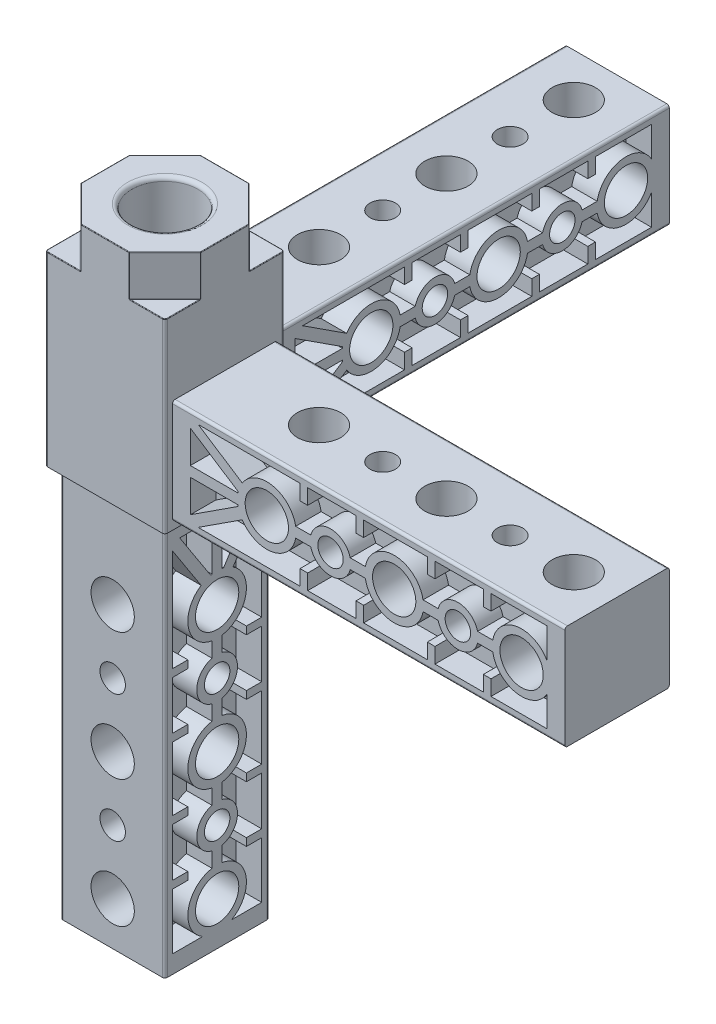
SolidWorks part; units mm, degrees
ref_plane "前视基准面" through (0, 0, 0) normal (0, 0, 1) x (1, 0, 0)
ref_plane "上视基准面" through (0, 0, 0) normal (0, 1, 0) x (1, 0, 0)
ref_plane "右视基准面" through (0, 0, 0) normal (1, 0, 0) x (0, 0, -1)
sketch "草图1" plane through (0, 0, 0) normal (0, 1, 0) x (1, 0, 0)
  line L1 (-11.25, -11.75) -> (11.25, -11.75)
  line L2 (-11.75, -11.25) -> (-11.75, 11.25)
  line L3 (-11.25, 11.75) -> (11.25, 11.75)
  line L4 (11.75, -11.25) -> (11.75, 11.25)
  line L5 (-11.75, -11.75) -> (11.75, 11.75) construction
  line L6 (-11.75, 11.75) -> (11.75, -11.75) construction
  arc A0 (-11.25, -11.75) -> (-11.75, -11.25) centre (-11.25, -11.25) cw
  arc A1 (-11.75, 11.25) -> (-11.25, 11.75) centre (-11.25, 11.25) cw
  arc A2 (11.25, 11.75) -> (11.75, 11.25) centre (11.25, 11.25) cw
  arc A3 (11.25, -11.75) -> (11.75, -11.25) centre (11.25, -11.25) ccw
  point P0 (0, 0)
  dimension "D3" = 0.5
  dimension "D1" = 23.5
  dimension "D2" = 23.5
extrude "拉伸1" add sketch "草图1" along normal blind 44.5
sketch "草图2" plane through (0, 44.5, 0) normal (0, 1, 0) x (1, 0, 0)
  line L0 (0, 0) -> (50000, 0) construction
  line L1 (0, 0) -> (0, 50000) construction
  line L2 (-11.25, -11.75) -> (11.25, -11.75) construction
  line L3 (11.75, -11.25) -> (11.75, 11.25) construction
  line L4 (-11.75, 11.25) -> (-11.75, -11.25) construction
  line L5 (11.25, 11.75) -> (-11.25, 11.75) construction
  line L6 (-11.25, -11.75) -> (-4.75, -11.75)
  line L7 (11.75, -11.25) -> (11.75, -4.75)
  line L8 (-11.75, 11.25) -> (-11.75, 4.75)
  line L9 (11.25, 11.75) -> (4.75, 11.75)
  line L10 (-4.75, 11.75) -> (-11.75, 4.75)
  line L11 (4.75, 11.75) -> (11.75, 4.75)
  line L12 (4.75, -11.75) -> (11.75, -4.75)
  line L13 (-4.75, -11.75) -> (-11.75, -4.75)
  line L14 (4.75, -11.75) -> (11.25, -11.75)
  line L15 (-11.75, -4.75) -> (-11.75, -11.25)
  line L16 (11.75, 4.75) -> (11.75, 11.25)
  line L17 (-4.75, 11.75) -> (-11.25, 11.75)
  arc A0 (-11.75, -11.25) -> (-11.25, -11.75) centre (-11.25, -11.25) ccw construction
  arc A1 (11.25, -11.75) -> (11.75, -11.25) centre (11.25, -11.25) ccw construction
  arc A2 (11.75, 11.25) -> (11.25, 11.75) centre (11.25, 11.25) ccw construction
  arc A3 (-11.25, 11.75) -> (-11.75, 11.25) centre (-11.25, 11.25) ccw construction
  arc A4 (-11.75, -11.25) -> (-11.25, -11.75) centre (-11.25, -11.25) ccw
  arc A5 (11.25, -11.75) -> (11.75, -11.25) centre (11.25, -11.25) ccw
  arc A6 (11.75, 11.25) -> (11.25, 11.75) centre (11.25, 11.25) ccw
  arc A7 (-11.25, 11.75) -> (-11.75, 11.25) centre (-11.25, 11.25) ccw
  dimension "D1" = 45
  dimension "D2" = 7
extrude "拉伸2" cut sketch "草图2" against normal blind 8
sketch "草图3" plane through (0, 44.5, 0) normal (0, 1, 0) x (1, 0, 0)
  circle A0 centre (0, 0) radius 6.5
  dimension "D1" = 13
extrude "拉伸3" cut sketch "草图3" against normal blind 25
fillet "圆角1" radius 0.8 1 edges at (0, 44.5, 6.5)
fillet "圆角2" radius 0.1 32 edges at (11.75, 40.5, -4.75) (11.75, 36.5, -8) (11.6036, 36.5, 11.6036) (-11.6036, 36.5, 11.6036) (11.6036, 36.5, -11.6036) (11.75, 36.5, 8) (8, 36.5, 11.75) (-8, 36.5, 11.75) (-11.75, 36.5, 8) (8, 36.5, -11.75) (11.75, 40.5, 4.75) (8.25, 36.5, 8.25) (4.75, 40.5, 11.75) (8.25, 44.5, 8.25) (-4.75, 40.5, 11.75) (-8.25, 36.5, 8.25) (-11.75, 40.5, 4.75) (-8.25, 44.5, 8.25) (-11.75, 40.5, -4.75) (-4.75, 40.5, -11.75) (-8.25, 44.5, -8.25) (-8, 36.5, -11.75) (-8.25, 36.5, -8.25) (-11.75, 36.5, -8) (-11.6036, 36.5, -11.6036) (0, 44.5, 11.75) (-11.75, 44.5, 0) (8.25, 36.5, -8.25) (4.75, 40.5, -11.75) (0, 44.5, -11.75) (8.25, 44.5, -8.25) (11.75, 44.5, 0)
sketch "草图4" plane through (0, 0, 0) normal (0, -1, 0) x (1, 0, 0)
  line L1 (-9.75, -10.25) -> (9.75, -10.25)
  line L2 (-10.25, -9.75) -> (-10.25, 9.75)
  line L3 (-9.75, 10.25) -> (9.75, 10.25)
  line L4 (10.25, -9.75) -> (10.25, 9.75)
  line L5 (-10.25, -10.25) -> (10.25, 10.25) construction
  line L6 (-10.25, 10.25) -> (10.25, -10.25) construction
  arc A0 (-10.25, 9.75) -> (-9.75, 10.25) centre (-9.75, 9.75) cw
  arc A1 (9.75, 10.25) -> (10.25, 9.75) centre (9.75, 9.75) cw
  arc A2 (9.75, -10.25) -> (10.25, -9.75) centre (9.75, -9.75) ccw
  arc A3 (-9.75, -10.25) -> (-10.25, -9.75) centre (-9.75, -9.75) cw
  point P0 (0, 0)
  dimension "D3" = 0.5
  dimension "D1" = 20.5
  dimension "D2" = 20.5
extrude "拉伸4" add sketch "草图4" along normal blind 77
sketch "草图5" plane through (11.75, 0, 0) normal (1, 0, 0) x (0, 0, -1)
  line L0 (0, 0) -> (0, 44.4) construction
  line L1 (4.7086, 44.4) -> (-4.7086, 44.4) construction
  line L2 (9.75, 0) -> (-9.75, 0) construction
  line L3 (-9.75, 1.5) -> (9.75, 1.5)
  line L4 (-10.25, 2) -> (-10.25, 21.5)
  line L5 (-9.75, 22) -> (9.75, 22)
  line L6 (10.25, 2) -> (10.25, 21.5)
  line L7 (-10.25, 1.5) -> (10.25, 22) construction
  line L8 (-10.25, 22) -> (10.25, 1.5) construction
  arc A0 (-10.25, 21.5) -> (-9.75, 22) centre (-9.75, 21.5) cw
  arc A1 (9.75, 22) -> (10.25, 21.5) centre (9.75, 21.5) cw
  arc A2 (-9.75, 1.5) -> (-10.25, 2) centre (-9.75, 2) cw
  arc A3 (9.75, 1.5) -> (10.25, 2) centre (9.75, 2) ccw
  point P5 (0, 11.75)
  dimension "D4" = 0.5
  dimension "D1" = 1.5
  dimension "D2" = 20.5
  dimension "D3" = 20.5
extrude "拉伸5" add sketch "草图5" along normal blind 77
sketch "草图6" plane through (0, 0, -11.75) normal (0, 0, -1) x (-1, 0, 0)
  line L0 (0, 44.4) -> (0, 0) construction
  line L1 (4.7086, 44.4) -> (-4.7086, 44.4) construction
  line L2 (9.75, 0) -> (-9.75, 0) construction
  line L3 (-9.75, 1.5) -> (9.75, 1.5)
  line L4 (-10.25, 2) -> (-10.25, 21.5)
  line L5 (-9.75, 22) -> (9.75, 22)
  line L6 (10.25, 2) -> (10.25, 21.5)
  line L7 (-10.25, 1.5) -> (10.25, 22) construction
  line L8 (-10.25, 22) -> (10.25, 1.5) construction
  arc A0 (-10.25, 21.5) -> (-9.75, 22) centre (-9.75, 21.5) cw
  arc A1 (-9.75, 1.5) -> (-10.25, 2) centre (-9.75, 2) cw
  arc A2 (9.75, 1.5) -> (10.25, 2) centre (9.75, 2) ccw
  arc A3 (9.75, 22) -> (10.25, 21.5) centre (9.75, 21.5) cw
  point P5 (0, 11.75)
  dimension "D4" = 0.5
  dimension "D1" = 20.5
  dimension "D2" = 20.5
  dimension "D3" = 1.5
extrude "拉伸6" add sketch "草图6" along normal blind 77
sketch "草图7"
sketch_block_instance "块1-1"
sketch_block "块1" parameters "D8"=11.5, "D9"=8, "D20"=5.75, "D21"=4, "D22"=5.75, "D1"=2, "D2"=33, "D3"=2, "D4"=12.5, "D5"=12.5, "D6"=12.5, "D7"=12.5, "D10"=2, "D11"=3, "D12"=1.5, "D13"=9.4789, "D14"=12.5, "D15"=9.5, "D16"=11, "D17"=1.5, "D18"=1.5, "D19"=1.5
extrude "拉伸7" cut sketch "草图7" against normal blind 5
sketch "草图8" plane through (-10.25, 0, 0) normal (-1, 0, 0) x (0, 0, 1)
  line L52 (-7.3564, -3.5) -> (-1, -3.5)
  line L53 (-1, -3.5) -> (-1, -12.8376)
  line L54 (-7.3564, -3.5) -> (-1.2588, -12.8895)
  line L55 (-8.75, -5.0262) -> (-3.1317, -13.6776)
  line L56 (-8.75, -25.0211) -> (-8.75, -5.0262)
  line L57 (-8.75, -25.0211) -> (-5.75, -25.0211)
  line L58 (-8.75, -26.5211) -> (-5.75, -26.5211)
  line L59 (-5.75, -26.5211) -> (-5.75, -25.0211)
  line L60 (1, -27.127) -> (1, -24.1624)
  line L61 (-1, -27.127) -> (-1, -24.1624)
  line L62 (1, -3.5) -> (7.3564, -3.5)
  line L63 (1, -12.8376) -> (1, -3.5)
  line L64 (1.2588, -12.8895) -> (7.3564, -3.5)
  line L65 (3.1317, -13.6776) -> (8.75, -5.0262)
  line L66 (8.75, -5.0262) -> (8.75, -25.0211)
  line L67 (8.75, -25.0211) -> (5.75, -25.0211)
  line L68 (5.75, -25.0211) -> (5.75, -26.5211)
  line L69 (8.75, -36) -> (8.75, -26.5211)
  line L70 (5.75, -26.5211) -> (8.75, -26.5211)
  line L71 (-8.75, -36) -> (-8.75, -26.5211)
  line L72 (-8.75, -36) -> (-5.75, -36)
  line L73 (-5.75, -37.5) -> (-5.75, -36)
  line L74 (-8.75, -37.5) -> (-5.75, -37.5)
  line L75 (-1, -37.8376) -> (-1, -34.873)
  line L76 (1, -37.8376) -> (1, -34.873)
  line L77 (5.75, -37.5) -> (5.75, -36)
  line L78 (8.75, -36) -> (5.75, -36)
  line L79 (5.75, -37.5) -> (8.75, -37.5)
  line L80 (8.75, -50) -> (8.75, -37.5)
  line L81 (8.75, -50) -> (5.75, -50)
  line L82 (5.75, -51.5) -> (5.75, -50)
  line L83 (5.75, -51.5) -> (8.75, -51.5)
  line L84 (8.75, -61) -> (8.75, -51.5)
  line L85 (5.75, -62.5) -> (5.75, -61)
  line L86 (8.75, -61) -> (5.75, -61)
  line L87 (5.75, -62.5) -> (8.75, -62.5)
  line L88 (-1, -52.127) -> (-1, -49.1624)
  line L89 (1, -52.127) -> (1, -49.1624)
  line L90 (-8.75, -50) -> (-8.75, -37.5)
  line L91 (-8.75, -50) -> (-5.75, -50)
  line L92 (-5.75, -51.5) -> (-5.75, -50)
  line L93 (-8.75, -51.5) -> (-5.75, -51.5)
  line L94 (-8.75, -61) -> (-8.75, -51.5)
  line L95 (-5.75, -62.5) -> (-5.75, -61)
  line L96 (-8.75, -61) -> (-5.75, -61)
  line L97 (-8.75, -62.5) -> (-5.75, -62.5)
  line L98 (-8.75, -73.5) -> (-8.75, -62.5)
  line L99 (-8.75, -73.5) -> (-2.8395, -73.5)
  line L100 (-1, -62.8376) -> (-1, -59.873)
  line L101 (1, -62.8376) -> (1, -59.873)
  line L102 (8.75, -73.5) -> (8.75, -62.5)
  line L103 (8.75, -73.5) -> (2.8395, -73.5)
  line L104 (1, -3.5) -> (7.3564, -3.5)
  line L105 (-1, -52.127) -> (-1, -49.1624)
  line L106 (-1, -37.8376) -> (-1, -34.873)
  line L107 (-1, -27.127) -> (-1, -24.1624)
  line L108 (-1, -12.8376) -> (-1, -3.5)
  line L109 (-8.75, -61) -> (-8.75, -51.5)
  line L110 (-8.75, -50) -> (-8.75, -37.5)
  line L111 (-8.75, -36) -> (-8.75, -26.5211)
  line L112 (-8.75, -25.0211) -> (-8.75, -5.0262)
  line L113 (5.75, -25.0211) -> (8.75, -25.0211)
  line L114 (5.75, -26.5211) -> (8.75, -26.5211)
  line L115 (-5.75, -51.5) -> (-5.75, -50)
  line L116 (-5.75, -37.5) -> (-5.75, -36)
  line L117 (-5.75, -26.5211) -> (-5.75, -25.0211)
  line L118 (1, -52.127) -> (1, -49.1624)
  line L119 (1, -37.8376) -> (1, -34.873)
  line L120 (1, -27.127) -> (1, -24.1624)
  line L121 (1, -12.8376) -> (1, -3.5)
  line L122 (8.75, -61) -> (8.75, -51.5)
  line L123 (8.75, -50) -> (8.75, -37.5)
  line L124 (8.75, -36) -> (8.75, -26.5211)
  line L125 (8.75, -25.0211) -> (8.75, -5.0262)
  line L126 (5.75, -51.5) -> (5.75, -50)
  line L127 (5.75, -37.5) -> (5.75, -36)
  line L128 (5.75, -26.5211) -> (5.75, -25.0211)
  line L129 (5.75, -36) -> (8.75, -36)
  line L130 (5.75, -37.5) -> (8.75, -37.5)
  line L131 (5.75, -50) -> (8.75, -50)
  line L132 (5.75, -51.5) -> (8.75, -51.5)
  line L133 (5.75, -61) -> (8.75, -61)
  line L134 (5.75, -62.5) -> (8.75, -62.5)
  line L135 (2.8395, -73.5) -> (8.75, -73.5)
  arc A0 (-3.1317, -13.6776) -> (-1, -24.1624) centre (0, -18.5) ccw construction
  arc A1 (1, -24.1624) -> (3.1317, -13.6776) centre (0, -18.5) ccw construction
  arc A2 (-1, -27.127) -> (-1, -34.873) centre (0, -31) ccw construction
  arc A3 (1, -34.873) -> (1, -27.127) centre (0, -31) ccw construction
  arc A4 (1, -59.873) -> (1, -52.127) centre (0, -56) ccw construction
  arc A5 (-1, -52.127) -> (-1, -59.873) centre (0, -56) ccw construction
  arc A6 (1, -49.1624) -> (1, -37.8376) centre (0, -43.5) ccw construction
  arc A7 (-1, -37.8376) -> (-1, -49.1624) centre (0, -43.5) ccw construction
  arc A8 (-1, -62.8376) -> (-2.8395, -73.5) centre (0, -68.5) ccw construction
  arc A9 (2.8395, -73.5) -> (1, -62.8376) centre (0, -68.5) ccw construction
  arc A10 (-3.1317, -13.6776) -> (-1, -24.1624) centre (0, -18.5) ccw
  arc A11 (1, -24.1624) -> (3.1317, -13.6776) centre (0, -18.5) ccw
  arc A12 (-1, -27.127) -> (-1, -34.873) centre (0, -31) ccw
  arc A13 (1, -34.873) -> (1, -27.127) centre (0, -31) ccw
  arc A14 (1, -59.873) -> (1, -52.127) centre (0, -56) ccw
  arc A15 (-1, -52.127) -> (-1, -59.873) centre (0, -56) ccw
  arc A16 (1, -49.1624) -> (1, -37.8376) centre (0, -43.5) ccw
  arc A17 (-1, -37.8376) -> (-1, -49.1624) centre (0, -43.5) ccw
  arc A18 (-1, -62.8376) -> (-2.8395, -73.5) centre (0, -68.5) ccw
  arc A19 (2.8395, -73.5) -> (1, -62.8376) centre (0, -68.5) ccw
  arc A20 (-1, -12.8376) -> (-1.2588, -12.8895) centre (0, -18.5) ccw construction
  arc A21 (1.2588, -12.8895) -> (1, -12.8376) centre (0, -18.5) ccw construction
  arc A22 (-1, -12.8376) -> (-1.2588, -12.8895) centre (0, -18.5) ccw
  arc A23 (1.2588, -12.8895) -> (1, -12.8376) centre (0, -18.5) ccw
extrude "拉伸8" cut sketch "草图8" against normal blind 5 contours A18 L100 A15 L88 A17 L75 A12 L61 A10 L55 L56 L57 L59 L58 L71 L72 L73 L74 L90 L91 L92 L93 L94 L96 L95 L97 L98 L99 | A22 L53 L52 L54 | A23 L64 L62 L63 | A19 L103 L102 L87 L85 L86 L84 L83 L82 L81 L80 L79 L77 L78 L69 L70 L68 L67 L66 L65 A11 L60 A13 L76 A16 L89 A14 L101
sketch "草图9" plane through (0, 0, -10.25) normal (0, 0, -1) x (-1, 0, 0)
  line L0 (-11.75, 2) -> (-11.75, 21.5) construction
  line B0 (-85.25, 20.5) -> (-85.25, 14.5895)
  line B1 (-85.25, 20.5) -> (-74.25, 20.5)
  line B2 (-85.25, 3) -> (-74.25, 3)
  line B3 (-15.25, 10.75) -> (-24.5876, 10.75)
  line B4 (-74.5876, 12.75) -> (-71.623, 12.75)
  line B5 (-16.7762, 20.5) -> (-25.4276, 14.8817)
  line B6 (-15.25, 19.1064) -> (-15.25, 12.75)
  line B7 (-15.25, 19.1064) -> (-24.6395, 13.0088)
  line B8 (-16.7762, 3) -> (-25.4276, 8.6183)
  line B9 (-15.25, 4.3936) -> (-24.6395, 10.4912)
  line B10 (-47.75, 3) -> (-47.75, 6)
  line B11 (-36.7711, 3) -> (-36.7711, 6)
  line B12 (-72.75, 17.5) -> (-74.25, 17.5)
  line B13 (-38.2711, 3) -> (-38.2711, 6)
  line B14 (-36.7711, 6) -> (-38.2711, 6)
  line B15 (-74.25, 20.5) -> (-74.25, 17.5)
  line B16 (-49.25, 3) -> (-49.25, 6)
  line B17 (-47.75, 6) -> (-49.25, 6)
  line B18 (-61.75, 3) -> (-61.75, 6)
  line B19 (-72.75, 20.5) -> (-72.75, 17.5)
  line B20 (-63.25, 3) -> (-63.25, 6)
  line B21 (-61.75, 6) -> (-63.25, 6)
  line B22 (-72.75, 3) -> (-72.75, 6)
  line B23 (-61.75, 17.5) -> (-63.25, 17.5)
  line B24 (-74.25, 3) -> (-74.25, 6)
  line B25 (-72.75, 6) -> (-74.25, 6)
  line B26 (-63.25, 20.5) -> (-63.25, 17.5)
  line B27 (-61.75, 20.5) -> (-61.75, 17.5)
  line B28 (-47.75, 17.5) -> (-49.25, 17.5)
  line B29 (-49.25, 20.5) -> (-49.25, 17.5)
  line B30 (-36.7711, 17.5) -> (-38.2711, 17.5)
  line B31 (-38.2711, 20.5) -> (-38.2711, 17.5)
  line B32 (-36.7711, 20.5) -> (-36.7711, 17.5)
  line B33 (-47.75, 20.5) -> (-47.75, 17.5)
  line B34 (-85.25, 8.9105) -> (-85.25, 3)
  line B35 (-63.877, 12.75) -> (-60.9124, 12.75)
  line B36 (-71.623, 10.75) -> (-74.5876, 10.75)
  line B37 (-72.75, 3) -> (-63.25, 3)
  line B38 (-72.75, 20.5) -> (-63.25, 20.5)
  line B39 (-61.75, 20.5) -> (-49.25, 20.5)
  line B40 (-60.9124, 10.75) -> (-63.877, 10.75)
  line B41 (-49.5876, 12.75) -> (-46.623, 12.75)
  line B42 (-61.75, 3) -> (-49.25, 3)
  line B43 (-47.75, 3) -> (-38.2711, 3)
  line B44 (-47.75, 20.5) -> (-38.2711, 20.5)
  line B45 (-36.7711, 20.5) -> (-16.7762, 20.5)
  line B46 (-36.7711, 3) -> (-16.7762, 3)
  line B47 (-46.623, 10.75) -> (-49.5876, 10.75)
  line B48 (-38.877, 12.75) -> (-35.9124, 12.75)
  line B49 (-35.9124, 10.75) -> (-38.877, 10.75)
  line B50 (-24.5876, 12.75) -> (-15.25, 12.75)
  line B51 (-15.25, 10.75) -> (-15.25, 4.3936)
  arc B52 (-85.25, 8.9105) -> (-74.5876, 10.75) centre (-80.25, 11.75) ccw
  arc B53 (-63.877, 12.75) -> (-71.623, 12.75) centre (-67.75, 11.75) ccw
  arc B54 (-49.5876, 12.75) -> (-60.9124, 12.75) centre (-55.25, 11.75) ccw
  arc B55 (-38.877, 12.75) -> (-46.623, 12.75) centre (-42.75, 11.75) ccw
  arc B56 (-24.6395, 10.4912) -> (-24.5876, 10.75) centre (-30.25, 11.75) ccw
  arc B57 (-35.9124, 10.75) -> (-25.4276, 8.6183) centre (-30.25, 11.75) ccw
  arc B58 (-46.623, 10.75) -> (-38.877, 10.75) centre (-42.75, 11.75) ccw
  arc B59 (-60.9124, 10.75) -> (-49.5876, 10.75) centre (-55.25, 11.75) ccw
  arc B60 (-71.623, 10.75) -> (-63.877, 10.75) centre (-67.75, 11.75) ccw
  arc B61 (-74.5876, 12.75) -> (-85.25, 14.5895) centre (-80.25, 11.75) ccw
  arc B62 (-24.5876, 12.75) -> (-24.6395, 13.0088) centre (-30.25, 11.75) ccw
  arc B63 (-25.4276, 14.8817) -> (-35.9124, 12.75) centre (-30.25, 11.75) ccw
sketch_block_instance "块1-2"
extrude "拉伸9" cut sketch "草图9" against normal blind 5
sketch "草图10" plane through (0, 0, 10.25) normal (0, 0, 1) x (1, 0, 0)
  line L0 (11.75, 11.75) -> (-19.8741, 11.75) construction
  line L1 (11.75, 21.5) -> (11.75, 2) construction
  line B0 (85.25, 3) -> (85.25, 8.9105)
  line B1 (85.25, 3) -> (74.25, 3)
  line B2 (85.25, 20.5) -> (74.25, 20.5)
  line B3 (15.25, 12.75) -> (24.5876, 12.75)
  line B4 (74.5876, 10.75) -> (71.623, 10.75)
  line B5 (16.7762, 3) -> (25.4276, 8.6183)
  line B6 (15.25, 4.3936) -> (15.25, 10.75)
  line B7 (15.25, 4.3936) -> (24.6395, 10.4912)
  line B8 (16.7762, 20.5) -> (25.4276, 14.8817)
  line B9 (15.25, 19.1064) -> (24.6395, 13.0088)
  line B10 (47.75, 20.5) -> (47.75, 17.5)
  line B11 (36.7711, 20.5) -> (36.7711, 17.5)
  line B12 (72.75, 6) -> (74.25, 6)
  line B13 (38.2711, 20.5) -> (38.2711, 17.5)
  line B14 (36.7711, 17.5) -> (38.2711, 17.5)
  line B15 (74.25, 3) -> (74.25, 6)
  line B16 (49.25, 20.5) -> (49.25, 17.5)
  line B17 (47.75, 17.5) -> (49.25, 17.5)
  line B18 (61.75, 20.5) -> (61.75, 17.5)
  line B19 (72.75, 3) -> (72.75, 6)
  line B20 (63.25, 20.5) -> (63.25, 17.5)
  line B21 (61.75, 17.5) -> (63.25, 17.5)
  line B22 (72.75, 20.5) -> (72.75, 17.5)
  line B23 (61.75, 6) -> (63.25, 6)
  line B24 (74.25, 20.5) -> (74.25, 17.5)
  line B25 (72.75, 17.5) -> (74.25, 17.5)
  line B26 (63.25, 3) -> (63.25, 6)
  line B27 (61.75, 3) -> (61.75, 6)
  line B28 (47.75, 6) -> (49.25, 6)
  line B29 (49.25, 3) -> (49.25, 6)
  line B30 (36.7711, 6) -> (38.2711, 6)
  line B31 (38.2711, 3) -> (38.2711, 6)
  line B32 (36.7711, 3) -> (36.7711, 6)
  line B33 (47.75, 3) -> (47.75, 6)
  line B34 (85.25, 14.5895) -> (85.25, 20.5)
  line B35 (63.877, 10.75) -> (60.9124, 10.75)
  line B36 (71.623, 12.75) -> (74.5876, 12.75)
  line B37 (72.75, 20.5) -> (63.25, 20.5)
  line B38 (72.75, 3) -> (63.25, 3)
  line B39 (61.75, 3) -> (49.25, 3)
  line B40 (60.9124, 12.75) -> (63.877, 12.75)
  line B41 (49.5876, 10.75) -> (46.623, 10.75)
  line B42 (61.75, 20.5) -> (49.25, 20.5)
  line B43 (47.75, 20.5) -> (38.2711, 20.5)
  line B44 (47.75, 3) -> (38.2711, 3)
  line B45 (36.7711, 3) -> (16.7762, 3)
  line B46 (36.7711, 20.5) -> (16.7762, 20.5)
  line B47 (46.623, 12.75) -> (49.5876, 12.75)
  line B48 (38.877, 10.75) -> (35.9124, 10.75)
  line B49 (35.9124, 12.75) -> (38.877, 12.75)
  line B50 (24.5876, 10.75) -> (15.25, 10.75)
  line B51 (15.25, 12.75) -> (15.25, 19.1064)
  arc B52 (85.25, 14.5895) -> (74.5876, 12.75) centre (80.25, 11.75) ccw
  arc B53 (63.877, 10.75) -> (71.623, 10.75) centre (67.75, 11.75) ccw
  arc B54 (49.5876, 10.75) -> (60.9124, 10.75) centre (55.25, 11.75) ccw
  arc B55 (38.877, 10.75) -> (46.623, 10.75) centre (42.75, 11.75) ccw
  arc B56 (24.6395, 13.0088) -> (24.5876, 12.75) centre (30.25, 11.75) ccw
  arc B57 (35.9124, 12.75) -> (25.4276, 14.8817) centre (30.25, 11.75) ccw
  arc B58 (46.623, 12.75) -> (38.877, 12.75) centre (42.75, 11.75) ccw
  arc B59 (60.9124, 12.75) -> (49.5876, 12.75) centre (55.25, 11.75) ccw
  arc B60 (71.623, 12.75) -> (63.877, 12.75) centre (67.75, 11.75) ccw
  arc B61 (74.5876, 10.75) -> (85.25, 8.9105) centre (80.25, 11.75) ccw
  arc B62 (24.5876, 10.75) -> (24.6395, 10.4912) centre (30.25, 11.75) ccw
  arc B63 (25.4276, 8.6183) -> (35.9124, 10.75) centre (30.25, 11.75) ccw
sketch_block_instance "块1-4"
extrude "拉伸10" cut sketch "草图10" against normal blind 5
sketch "草图12" plane through (10.25, 0, 0) normal (1, 0, 0) x (0, 0, -1)
  line L0 (13.25, 11.75) -> (-34.3017, 11.75) construction
  line L2 (11.75, 21.5) -> (11.75, 2) construction
  line B0 (85.25, 3) -> (85.25, 8.9105)
  line B1 (85.25, 3) -> (74.25, 3)
  line B2 (85.25, 20.5) -> (74.25, 20.5)
  line B3 (15.25, 12.75) -> (24.5876, 12.75)
  line B4 (74.5876, 10.75) -> (71.623, 10.75)
  line B5 (16.7762, 3) -> (25.4276, 8.6183)
  line B6 (15.25, 4.3936) -> (15.25, 10.75)
  line B7 (15.25, 4.3936) -> (24.6395, 10.4912)
  line B8 (16.7762, 20.5) -> (25.4276, 14.8817)
  line B9 (15.25, 19.1064) -> (24.6395, 13.0088)
  line B10 (47.75, 20.5) -> (47.75, 17.5)
  line B11 (36.7711, 20.5) -> (36.7711, 17.5)
  line B12 (72.75, 6) -> (74.25, 6)
  line B13 (38.2711, 20.5) -> (38.2711, 17.5)
  line B14 (36.7711, 17.5) -> (38.2711, 17.5)
  line B15 (74.25, 3) -> (74.25, 6)
  line B16 (49.25, 20.5) -> (49.25, 17.5)
  line B17 (47.75, 17.5) -> (49.25, 17.5)
  line B18 (61.75, 20.5) -> (61.75, 17.5)
  line B19 (72.75, 3) -> (72.75, 6)
  line B20 (63.25, 20.5) -> (63.25, 17.5)
  line B21 (61.75, 17.5) -> (63.25, 17.5)
  line B22 (72.75, 20.5) -> (72.75, 17.5)
  line B23 (61.75, 6) -> (63.25, 6)
  line B24 (74.25, 20.5) -> (74.25, 17.5)
  line B25 (72.75, 17.5) -> (74.25, 17.5)
  line B26 (63.25, 3) -> (63.25, 6)
  line B27 (61.75, 3) -> (61.75, 6)
  line B28 (47.75, 6) -> (49.25, 6)
  line B29 (49.25, 3) -> (49.25, 6)
  line B30 (36.7711, 6) -> (38.2711, 6)
  line B31 (38.2711, 3) -> (38.2711, 6)
  line B32 (36.7711, 3) -> (36.7711, 6)
  line B33 (47.75, 3) -> (47.75, 6)
  line B34 (85.25, 14.5895) -> (85.25, 20.5)
  line B35 (63.877, 10.75) -> (60.9124, 10.75)
  line B36 (71.623, 12.75) -> (74.5876, 12.75)
  line B37 (72.75, 20.5) -> (63.25, 20.5)
  line B38 (72.75, 3) -> (63.25, 3)
  line B39 (61.75, 3) -> (49.25, 3)
  line B40 (60.9124, 12.75) -> (63.877, 12.75)
  line B41 (49.5876, 10.75) -> (46.623, 10.75)
  line B42 (61.75, 20.5) -> (49.25, 20.5)
  line B43 (47.75, 20.5) -> (38.2711, 20.5)
  line B44 (47.75, 3) -> (38.2711, 3)
  line B45 (36.7711, 3) -> (16.7762, 3)
  line B46 (36.7711, 20.5) -> (16.7762, 20.5)
  line B47 (46.623, 12.75) -> (49.5876, 12.75)
  line B48 (38.877, 10.75) -> (35.9124, 10.75)
  line B49 (35.9124, 12.75) -> (38.877, 12.75)
  line B50 (24.5876, 10.75) -> (15.25, 10.75)
  line B51 (15.25, 12.75) -> (15.25, 19.1064)
  arc B52 (85.25, 14.5895) -> (74.5876, 12.75) centre (80.25, 11.75) ccw
  arc B53 (63.877, 10.75) -> (71.623, 10.75) centre (67.75, 11.75) ccw
  arc B54 (49.5876, 10.75) -> (60.9124, 10.75) centre (55.25, 11.75) ccw
  arc B55 (38.877, 10.75) -> (46.623, 10.75) centre (42.75, 11.75) ccw
  arc B56 (24.6395, 13.0088) -> (24.5876, 12.75) centre (30.25, 11.75) ccw
  arc B57 (35.9124, 12.75) -> (25.4276, 14.8817) centre (30.25, 11.75) ccw
  arc B58 (46.623, 12.75) -> (38.877, 12.75) centre (42.75, 11.75) ccw
  arc B59 (60.9124, 12.75) -> (49.5876, 12.75) centre (55.25, 11.75) ccw
  arc B60 (71.623, 12.75) -> (63.877, 12.75) centre (67.75, 11.75) ccw
  arc B61 (74.5876, 10.75) -> (85.25, 8.9105) centre (80.25, 11.75) ccw
  arc B62 (24.5876, 10.75) -> (24.6395, 10.4912) centre (30.25, 11.75) ccw
  arc B63 (25.4276, 8.6183) -> (35.9124, 10.75) centre (30.25, 11.75) ccw
sketch_block_instance "块1-6"
extrude "拉伸11" cut sketch "草图12" against normal blind 5
sketch "草图13" plane through (-10.25, 0, 0) normal (-1, 0, 0) x (0, 0, 1)
  line L0 (-11.75, 11.75) -> (27.1926, 11.75) construction
  line L1 (-11.75, 2) -> (-11.75, 21.5) construction
  line B0 (-85.25, 20.5) -> (-85.25, 14.5895)
  line B1 (-85.25, 20.5) -> (-74.25, 20.5)
  line B2 (-85.25, 3) -> (-74.25, 3)
  line B3 (-15.25, 10.75) -> (-24.5876, 10.75)
  line B4 (-74.5876, 12.75) -> (-71.623, 12.75)
  line B5 (-16.7762, 20.5) -> (-25.4276, 14.8817)
  line B6 (-15.25, 19.1064) -> (-15.25, 12.75)
  line B7 (-15.25, 19.1064) -> (-24.6395, 13.0088)
  line B8 (-16.7762, 3) -> (-25.4276, 8.6183)
  line B9 (-15.25, 4.3936) -> (-24.6395, 10.4912)
  line B10 (-47.75, 3) -> (-47.75, 6)
  line B11 (-36.7711, 3) -> (-36.7711, 6)
  line B12 (-72.75, 17.5) -> (-74.25, 17.5)
  line B13 (-38.2711, 3) -> (-38.2711, 6)
  line B14 (-36.7711, 6) -> (-38.2711, 6)
  line B15 (-74.25, 20.5) -> (-74.25, 17.5)
  line B16 (-49.25, 3) -> (-49.25, 6)
  line B17 (-47.75, 6) -> (-49.25, 6)
  line B18 (-61.75, 3) -> (-61.75, 6)
  line B19 (-72.75, 20.5) -> (-72.75, 17.5)
  line B20 (-63.25, 3) -> (-63.25, 6)
  line B21 (-61.75, 6) -> (-63.25, 6)
  line B22 (-72.75, 3) -> (-72.75, 6)
  line B23 (-61.75, 17.5) -> (-63.25, 17.5)
  line B24 (-74.25, 3) -> (-74.25, 6)
  line B25 (-72.75, 6) -> (-74.25, 6)
  line B26 (-63.25, 20.5) -> (-63.25, 17.5)
  line B27 (-61.75, 20.5) -> (-61.75, 17.5)
  line B28 (-47.75, 17.5) -> (-49.25, 17.5)
  line B29 (-49.25, 20.5) -> (-49.25, 17.5)
  line B30 (-36.7711, 17.5) -> (-38.2711, 17.5)
  line B31 (-38.2711, 20.5) -> (-38.2711, 17.5)
  line B32 (-36.7711, 20.5) -> (-36.7711, 17.5)
  line B33 (-47.75, 20.5) -> (-47.75, 17.5)
  line B34 (-85.25, 8.9105) -> (-85.25, 3)
  line B35 (-63.877, 12.75) -> (-60.9124, 12.75)
  line B36 (-71.623, 10.75) -> (-74.5876, 10.75)
  line B37 (-72.75, 3) -> (-63.25, 3)
  line B38 (-72.75, 20.5) -> (-63.25, 20.5)
  line B39 (-61.75, 20.5) -> (-49.25, 20.5)
  line B40 (-60.9124, 10.75) -> (-63.877, 10.75)
  line B41 (-49.5876, 12.75) -> (-46.623, 12.75)
  line B42 (-61.75, 3) -> (-49.25, 3)
  line B43 (-47.75, 3) -> (-38.2711, 3)
  line B44 (-47.75, 20.5) -> (-38.2711, 20.5)
  line B45 (-36.7711, 20.5) -> (-16.7762, 20.5)
  line B46 (-36.7711, 3) -> (-16.7762, 3)
  line B47 (-46.623, 10.75) -> (-49.5876, 10.75)
  line B48 (-38.877, 12.75) -> (-35.9124, 12.75)
  line B49 (-35.9124, 10.75) -> (-38.877, 10.75)
  line B50 (-24.5876, 12.75) -> (-15.25, 12.75)
  line B51 (-15.25, 10.75) -> (-15.25, 4.3936)
  arc B52 (-85.25, 8.9105) -> (-74.5876, 10.75) centre (-80.25, 11.75) ccw
  arc B53 (-63.877, 12.75) -> (-71.623, 12.75) centre (-67.75, 11.75) ccw
  arc B54 (-49.5876, 12.75) -> (-60.9124, 12.75) centre (-55.25, 11.75) ccw
  arc B55 (-38.877, 12.75) -> (-46.623, 12.75) centre (-42.75, 11.75) ccw
  arc B56 (-24.6395, 10.4912) -> (-24.5876, 10.75) centre (-30.25, 11.75) ccw
  arc B57 (-35.9124, 10.75) -> (-25.4276, 8.6183) centre (-30.25, 11.75) ccw
  arc B58 (-46.623, 10.75) -> (-38.877, 10.75) centre (-42.75, 11.75) ccw
  arc B59 (-60.9124, 10.75) -> (-49.5876, 10.75) centre (-55.25, 11.75) ccw
  arc B60 (-71.623, 10.75) -> (-63.877, 10.75) centre (-67.75, 11.75) ccw
  arc B61 (-74.5876, 12.75) -> (-85.25, 14.5895) centre (-80.25, 11.75) ccw
  arc B62 (-24.5876, 12.75) -> (-24.6395, 13.0088) centre (-30.25, 11.75) ccw
  arc B63 (-25.4276, 14.8817) -> (-35.9124, 12.75) centre (-30.25, 11.75) ccw
sketch_block_instance "块1-8"
extrude "拉伸12" cut sketch "草图13" against normal blind 5
sketch "草图14"
sketch_block_instance "块2-1"
sketch_block "块2" parameters "D1"=8.5, "D2"=5
extrude "拉伸13" cut sketch "草图14" against normal through all
sketch "草图15" plane through (0, 22, 0) normal (0, 1, 0) x (-1, 0, 0)
  line L0 (-11.75, 0) -> (-98.6653, 0) construction
  line L1 (-11.75, -9.75) -> (-11.75, 9.75) construction
  circle B0 centre (-80.25, 0) radius 4.25
  circle B1 centre (-67.75, 0) radius 2.5
  circle B2 centre (-55.25, 0) radius 4.25
  circle B3 centre (-42.75, 0) radius 2.5
  circle B4 centre (-30.25, 0) radius 4.25
  dimension "D1" = 18.5
sketch_block_instance "块2-3"
extrude "拉伸14" cut sketch "草图15" against normal through all
sketch "草图16" plane through (10.25, 0, 0) normal (1, 0, 0) x (0, 0, -1)
  line L0 (30.25, 11.75) -> (98.0099, 11.75) construction
  circle B0 centre (30.25, 11.75) radius 4.25
  circle B1 centre (42.75, 11.75) radius 2.5
  circle B2 centre (55.25, 11.75) radius 4.25
  circle B3 centre (67.75, 11.75) radius 2.5
  circle B4 centre (80.25, 11.75) radius 4.25
sketch_block_instance "块2-6"
extrude "拉伸15" cut sketch "草图16" against normal through all
sketch "草图17" plane through (0, 22, 0) normal (0, 1, 0) x (1, 0, 0)
  line L0 (0, 20.841) -> (0, 94.8507) construction
  line L1 (-9.75, 11.75) -> (9.75, 11.75) construction
  circle B0 centre (0, 80.25) radius 4.25
  circle B1 centre (0, 67.75) radius 2.5
  circle B2 centre (0, 55.25) radius 4.25
  circle B3 centre (0, 42.75) radius 2.5
  circle B4 centre (0, 30.25) radius 4.25
  dimension "D1" = 18.5
sketch_block_instance "块2-8"
extrude "拉伸16" cut sketch "草图17" against normal through all
sketch "草图18" plane through (10.25, 0, 0) normal (1, 0, 0) x (0, 0, -1)
  line L0 (0, -18.5) -> (0, -81.3782) construction
  circle B0 centre (0, -18.5) radius 4.25
  circle B1 centre (0, -31) radius 2.5
  circle B2 centre (0, -43.5) radius 4.25
  circle B3 centre (0, -56) radius 2.5
  circle B4 centre (0, -68.5) radius 4.25
sketch_block_instance "块2-10"
extrude "拉伸17" cut sketch "草图18" against normal through all
sketch "草图19" plane through (0, 0, 10.25) normal (0, 0, 1) x (1, 0, 0)
  line L0 (0, 0) -> (0, -82.054) construction
  line L1 (9.75, 0) -> (-9.75, 0) construction
  circle B0 centre (0, -18.5) radius 4.25
  circle B1 centre (0, -31) radius 2.5
  circle B2 centre (0, -43.5) radius 4.25
  circle B3 centre (0, -56) radius 2.5
  circle B4 centre (0, -68.5) radius 4.25
  dimension "D1" = 18.5
sketch_block_instance "块2-12"
extrude "拉伸18" cut sketch "草图19" against normal through all
